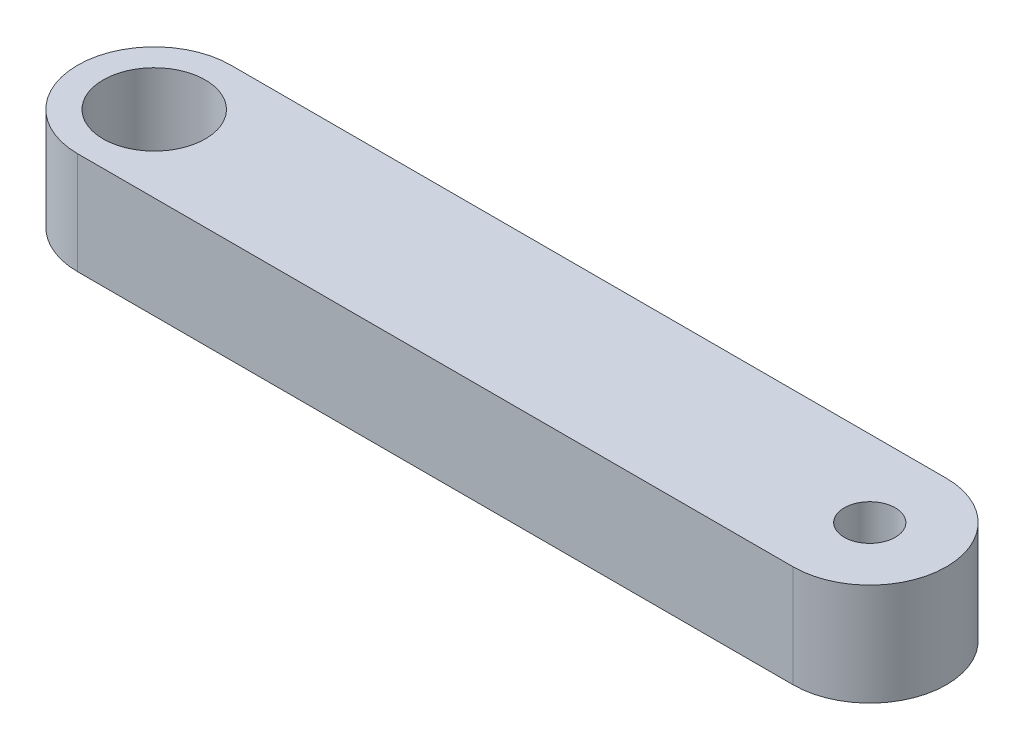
SolidWorks part; units mm, degrees
ref_plane "Płaszczyzna przednia" through (0, 0, 0) normal (0, 0, 1) x (1, 0, 0)
ref_plane "Płaszczyzna górna" through (0, 0, 0) normal (0, 1, 0) x (1, 0, 0)
ref_plane "Płaszczyzna prawa" through (0, 0, 0) normal (1, 0, 0) x (0, 0, -1)
sketch "Szkic1" plane through (0, 0, 0) normal (0, 1, 0) x (1, 0, 0)
  line L0 (0, 0) -> (70, 0) construction
  line L1 (0, 7.5) -> (70, 7.5)
  line L2 (0, -7.5) -> (70, -7.5)
  circle A0 centre (0, 0) radius 5
  arc A1 (0, 7.5) -> (0, -7.5) centre (0, 0) ccw
  arc A2 (70, -7.5) -> (70, 7.5) centre (70, 0) ccw
  circle A3 centre (70, 0) radius 2.5
  point P3 (35, 0)
  dimension "D1" = 10
  dimension "D2" = 7.5
  dimension "D4" = 5
  dimension "D3" = 70
extrude "Dodanie-wyciągnięcie1" add sketch "Szkic1" along normal blind 10
